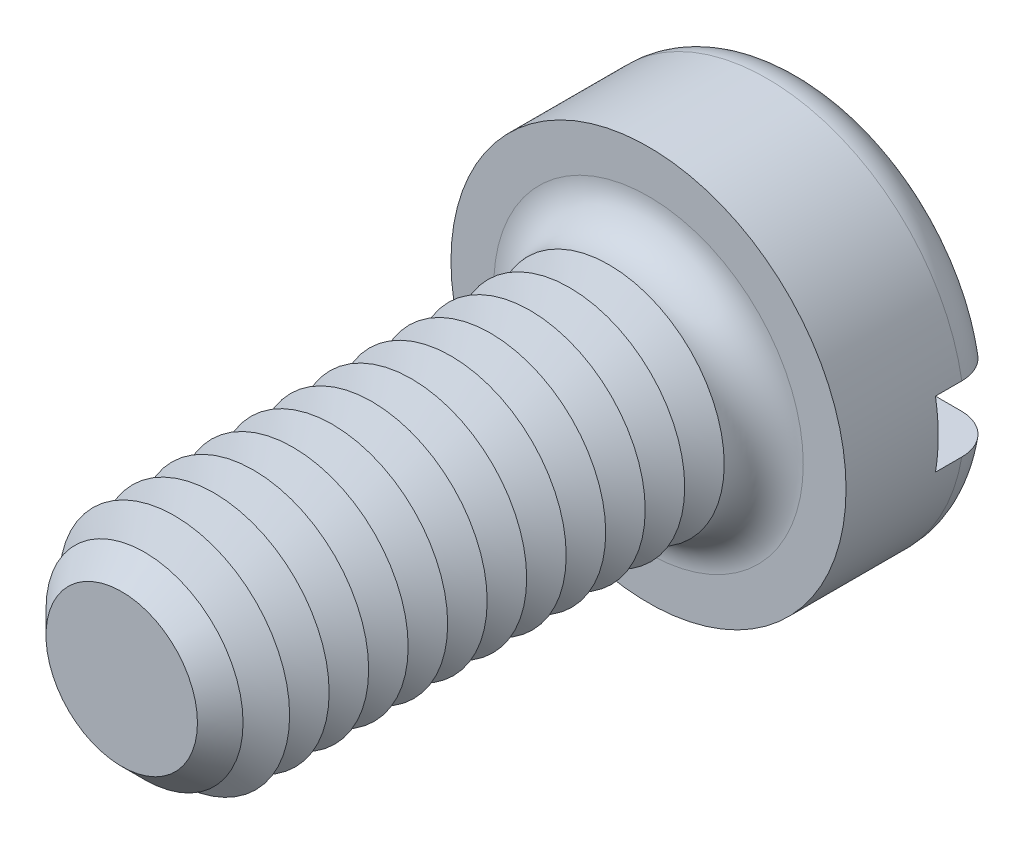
SolidWorks part; units mm, degrees
ref_plane "Front Plane" through (0, 0, 0) normal (0, 0, 1) x (1, 0, 0)
ref_plane "Top Plane" through (0, 0, 0) normal (0, 1, 0) x (1, 0, 0)
ref_plane "Right Plane" through (0, 0, 0) normal (1, 0, 0) x (0, 0, -1)
sketch "Sketch3" plane through (0, 0, 0) normal (0, 0, 1) x (1, 0, 0)
  circle A0 centre (0, 0) radius 3
  dimension "D1" = 6
extrude "Boss-Extrude2" add sketch "Sketch3" against normal blind 2.4
sketch "Sketch4" plane through (0, 0, 0) normal (0, 0, 1) x (1, 0, 0)
  circle A0 centre (0, 0) radius 1.75
  dimension "D1" = 3.5
extrude "Boss-Extrude3" add sketch "Sketch4" along normal blind 8
fillet "Fillet1" radius 0.6 2 edges at (3, 0, -2.4) (1.75, 0, 0)
chamfer "Chamfer1" distance 0.6 angle 45 1 edges at (1.75, 0, 8)
sketch "Sketch5" plane through (0, 0, 0) normal (1, 0, 0) x (0, 0, -1)
  line L0 (1.6944, 0) -> (-7.6738, 0) construction
sketch "Sketch6" plane through (0, 0, 0) normal (1, 0, 0) x (0, 0, -1)
  line L0 (-0.6, 1.75) -> (-0.9, 1.2304)
  line L1 (-0.9, 1.2304) -> (-1.2, 1.75)
  line L2 (-0.6, 1.75) -> (-7.4, 1.75) construction
  line L3 (-1.2, 1.75) -> (-0.6, 1.75)
  dimension "D1" = 0.6
revolve "Cut-Revolve1" cut sketch "Sketch6" angle 360 about L0
pattern_linear "LPattern1" count 12 spacing 0.6 along (0, 0, 1) of "Cut-Revolve1"
sketch "Sketch8" plane through (0, 0, -2.4) normal (0, 0, -1) x (-1, 0, 0)
  line L1 (3, -0.5) -> (-3, -0.5)
  line L2 (3, -0.5) -> (3, 0.5)
  line L3 (3, 0.5) -> (-3, 0.5)
  line L4 (-3, -0.5) -> (-3, 0.5)
  line L5 (3, -0.5) -> (-3, 0.5) construction
  line L6 (3, 0.5) -> (-3, -0.5) construction
  point P0 (0, 0)
  dimension "D1" = 6
  dimension "D2" = 1
extrude "Cut-Extrude1" cut sketch "Sketch8" against normal blind 1
